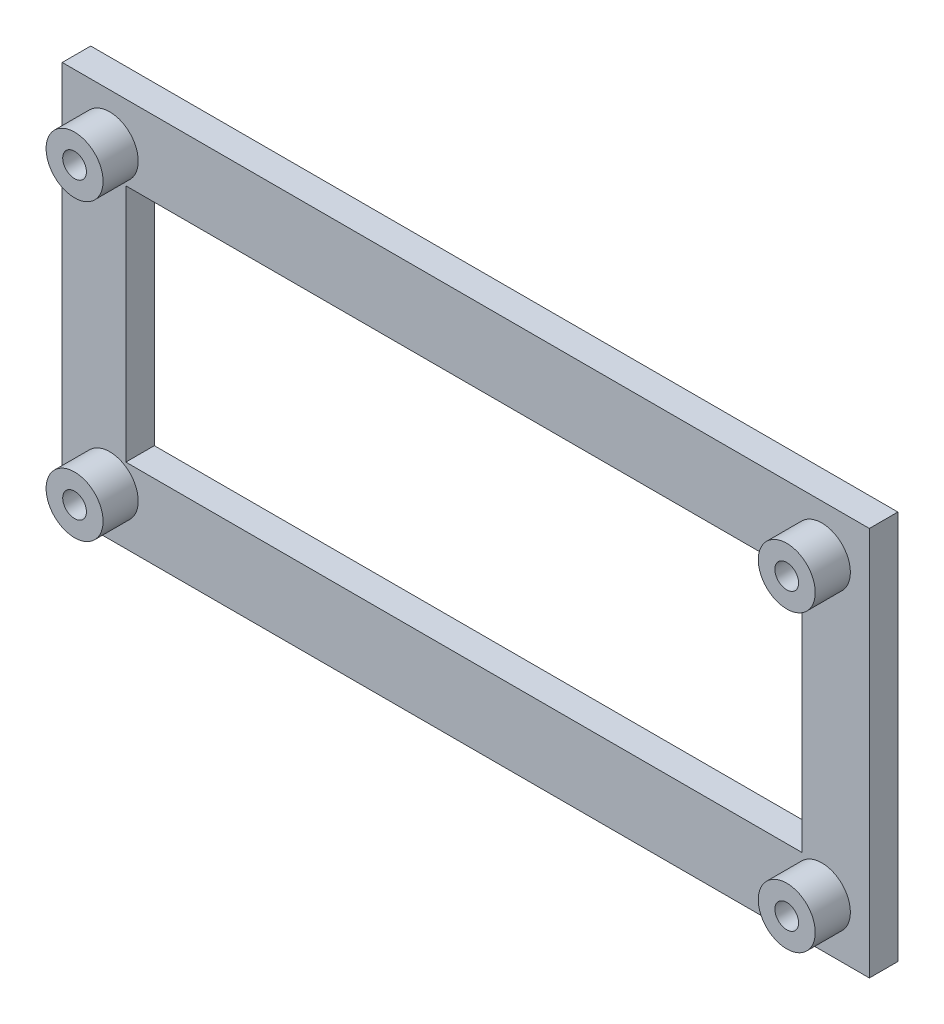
SolidWorks part; units mm, degrees
ref_plane "Ebene vorne" through (0, 0, 0) normal (0, 0, 1) x (1, 0, 0)
ref_plane "Ebene oben" through (0, 0, 0) normal (0, 1, 0) x (1, 0, 0)
ref_plane "Ebene rechts" through (0, 0, 0) normal (1, 0, 0) x (0, 0, -1)
sketch "Skizze1" plane through (0, 0, 0) normal (0, 0, 1) x (1, 0, 0)
  line L1 (-37.5, -15.5) -> (37.5, -15.5) construction
  line L2 (-37.5, -15.5) -> (-37.5, 15.5) construction
  line L3 (-37.5, 15.5) -> (37.5, 15.5) construction
  line L4 (37.5, -15.5) -> (37.5, 15.5) construction
  line L5 (-37.5, -15.5) -> (37.5, 15.5) construction
  line L6 (-37.5, 15.5) -> (37.5, -15.5) construction
  line L7 (-42.5, -20.5) -> (42.5, -20.5)
  line L8 (-42.5, -20.5) -> (-42.5, 20.5)
  line L9 (-42.5, 20.5) -> (42.5, 20.5)
  line L10 (42.5, -20.5) -> (42.5, 20.5)
  line L11 (-42.5, -20.5) -> (42.5, 20.5) construction
  line L12 (-42.5, 20.5) -> (42.5, -20.5) construction
  line L13 (-35.8, 12.6) -> (35.4, 12.6)
  line L14 (-35.8, 12.6) -> (-35.8, -12.6)
  line L15 (-35.8, -12.6) -> (35.4, -12.6)
  line L16 (35.4, 12.6) -> (35.4, -12.6)
  circle A0 centre (-37.5, 15.5) radius 3
  circle A1 centre (37.5, 15.5) radius 3
  circle A2 centre (37.5, -15.5) radius 3
  circle A3 centre (-37.5, -15.5) radius 3
  circle A4 centre (-37.5, -15.5) radius 1.25
  circle A5 centre (-37.5, 15.5) radius 1.25
  circle A6 centre (37.5, 15.5) radius 1.25
  circle A7 centre (37.5, -15.5) radius 1.25
  point P0 (0, 0)
  point P14 (0, 0)
  dimension "D3" = 2.5
  dimension "D4" = 6
  dimension "D5" = 2.5
  dimension "D6" = 6
  dimension "D7" = 2.5
  dimension "D8" = 6
  dimension "D9" = 2.5
  dimension "D10" = 6
  dimension "D1" = 31
  dimension "D2" = 75
  dimension "D11" = 5
  dimension "D12" = 5
  dimension "D13" = 71.2
  dimension "D14" = 25.2
  dimension "D15" = 1.7
  dimension "D16" = 2.9
extrude "Aufsatz-Linear austragen1" add sketch "Skizze1" along normal blind 3 contours L7 L10 L9 L8 A3 A2 A1 A0 L13 L16 L15 L14 | A0 A5 | A5 | A1 A6 | A6 | A2 A7 | A7 | A3 A4 | A4
sketch "Skizze2" plane through (0, 0, 3) normal (0, 0, 1) x (1, 0, 0)
  circle A0 centre (-37.5, 15.5) radius 1.25
  circle A1 centre (-37.5, 15.5) radius 3
  circle A2 centre (37.5, 15.5) radius 1.25
  circle A3 centre (37.5, 15.5) radius 3
  circle A4 centre (37.5, -15.5) radius 1.25
  circle A5 centre (37.5, -15.5) radius 3
  circle A6 centre (-37.5, -15.5) radius 1.25
  circle A7 centre (-37.5, -15.5) radius 3
  dimension "D1" = 6
  dimension "D2" = 2.5
  dimension "D3" = 2.5
  dimension "D4" = 6
  dimension "D5" = 2.5
  dimension "D6" = 6
  dimension "D7" = 2.5
  dimension "D8" = 6
extrude "Aufsatz-Linear austragen2" add sketch "Skizze2" along normal blind 3.7
